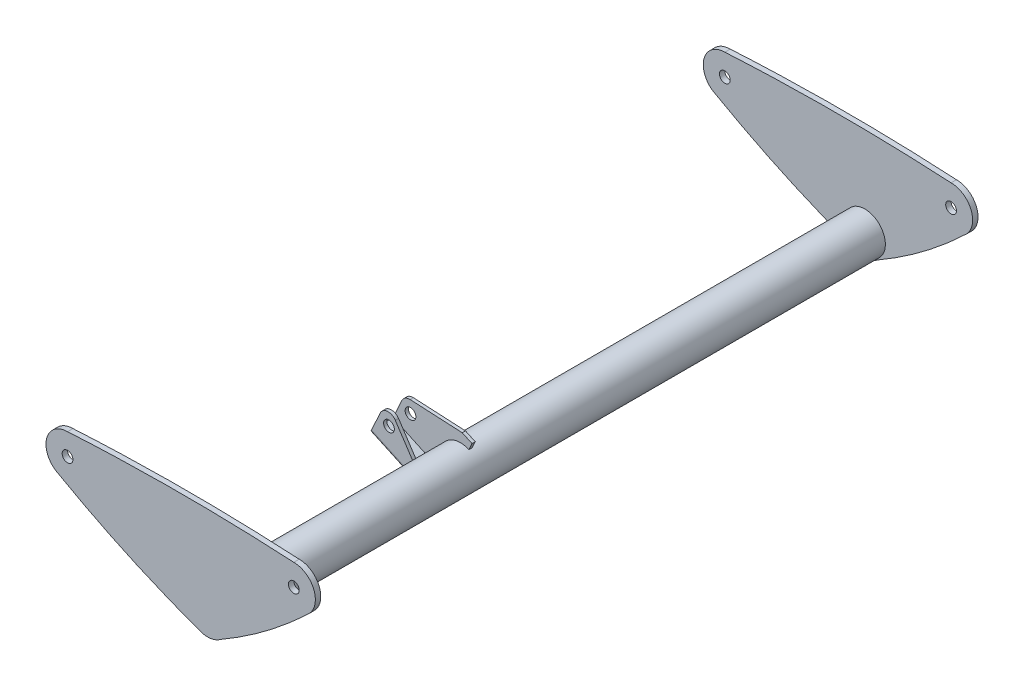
SolidWorks part; units mm, degrees
ref_plane "Plan de face" through (0, 0, 0) normal (0, 0, 1) x (1, 0, 0)
ref_plane "Plan de dessus" through (0, 0, 0) normal (0, 1, 0) x (1, 0, 0)
ref_plane "Plan de droite" through (0, 0, 0) normal (1, 0, 0) x (0, 0, -1)
sketch "Esquisse1" plane through (0, 0, 0) normal (0, 0, 1) x (1, 0, 0)
  line L0 (0, 20) -> (210, 20) construction
  line L1 (-8.3812, -18.1592) -> (121.6188, -78.1592) construction
  line L2 (142, -76) -> (222, -16) construction
  line L3 (105, 20) -> (105, 49.6761) construction
  line L4 (56.6188, -48.1592) -> (44.2232, -75.0164) construction
  line L5 (182, -46) -> (196.0565, -64.7421) construction
  circle A0 centre (0, 0) radius 5
  circle A1 centre (130, -60) radius 6.8924 construction
  circle A2 centre (210, 0) radius 5
  arc A3 (121.6188, -78.1592) -> (142, -76) centre (130, -60) ccw
  arc A4 (0, 20) -> (-8.3812, -18.1592) centre (0, 0) ccw
  arc A5 (222, -16) -> (210, 20) centre (210, 0) ccw
  spline S0 degree 2 poles (0, 20) (105, 26) (210, 20) knots 0 0 0 1 1 1
  spline S1 degree 2 poles (-8.3812, -18.1592) (54.1045, -53.6069) (121.6188, -78.1592) knots 0 0 0 1 1 1
  spline S2 degree 2 poles (142, -76) (185.6, -50.8) (222, -16) knots 0 0 0 1 1 1
  dimension "D1" = 10
  dimension "D3" = 40
  dimension "D4" = 130
  dimension "D5" = 60
  dimension "D2" = 210
  dimension "D6" = 3
  dimension "D7" = 3
  dimension "D8" = 3
extrude "Boss.-Extru.1" add sketch "Esquisse1" along normal blind 5
sketch "Esquisse2" plane through (0, 0, 0) normal (0, 0, -1) x (-1, 0, 0)
  circle A0 centre (-130, -60) radius 19
  dimension "D1" = 38
extrude "Extru.-Mince1" add sketch "Esquisse2" along normal blind 605 thin
ref_plane "Plan médian" through (0, 0, -302.5) normal (0, 0, -1) x (-1, 0, 0)
mirror "Symétrie1" about plane through (0, 0, -302.5) normal (0, 0, -1) of "Boss.-Extru.1"
ref_plane "Plan3" through (0, 0, -221) normal (0, 0, -1) x (-1, 0, 0)
ref_plane "Plan4" through (0, 0, -229.5) normal (0, 0, -1) x (-1, 0, 0)
sketch "Esquisse3" plane through (0, 0, -229.5) normal (0, 0, -1) x (-1, 0, 0)
  line L0 (-122.0379, -77.2512) -> (-67.5603, -52.1077)
  line L1 (-67.5603, -52.1077) -> (-75.7671, -34.3265)
  line L2 (-83.4458, -29.6897) -> (-131.8159, -32.2025)
  line L3 (-150.2605, -91.3784) -> (40.8812, -3.1592) construction
  line L4 (-140.8955, -36.3931) -> (-131.8159, -32.2025)
  line L5 (-130, -60) -> (-151.791, -12.7861) construction
  line L6 (-140.8955, -36.3931) -> (-137.9621, -42.7488)
  circle A0 centre (-130, -60) radius 19 construction
  arc A1 (-122.0379, -77.2512) -> (-137.9621, -42.7488) centre (-130, -60) ccw
  arc A2 (8.3812, -18.1592) -> (0, 20) centre (0, 0) ccw construction
  arc A3 (-142, -76) -> (-121.6188, -78.1592) centre (-130, -60) ccw construction
  arc A4 (-75.7671, -34.3265) -> (-83.4458, -29.6897) centre (-83.0307, -37.679) ccw
  point P19 (-78.0368, -29.4088)
  dimension "D5" = 8
  dimension "D1" = 60
  dimension "D2" = 25
  dimension "D3" = 45
  dimension "D4" = 10
extrude "Boss.-Extru.2" add sketch "Esquisse3" along normal blind 3
ref_plane "Plan5" through (0, 0, -212.5) normal (0, 0, -1) x (-1, 0, 0)
sketch "Esquisse4" plane through (0, 0, -212.5) normal (0, 0, -1) x (-1, 0, 0)
  line L0 (-67.5603, -52.1077) -> (-75.7671, -34.3265) construction
  line L4 (-67.5603, -52.1077) -> (-75.7671, -34.3265)
  line L5 (-89.7064, -33.2704) -> (-113.1256, -68.7324)
  line L10 (-122.0379, -77.2512) -> (-67.5603, -52.1077) construction
  line L11 (-122.0379, -77.2512) -> (-67.5603, -52.1077)
  arc A0 (-75.7671, -34.3265) -> (-83.4458, -29.6897) centre (-83.0307, -37.679) ccw construction
  arc A1 (-122.0379, -77.2512) -> (-137.9621, -42.7488) centre (-130, -60) ccw construction
  arc A2 (-75.7671, -34.3265) -> (-89.7064, -33.2704) centre (-83.0307, -37.679) ccw
  arc A3 (-122.0379, -77.2512) -> (-113.1256, -68.7324) centre (-130, -60) ccw
  dimension "D1" = 4
extrude "Boss.-Extru.3" add sketch "Esquisse4" against normal blind 3
sketch "Esquisse5" plane through (75.5224, -34.8565, 0) normal (-0.908, 0.4191, 0) x (0, 0, 1)
  line L0 (-212.5, -22) -> (-229.5, -22)
  line L1 (-209.5, -19) -> (-209.5, 0.5837) construction
  line L3 (-232.5, -19) -> (-232.5, 0.5837) construction
  line L5 (-200.8047, -19) -> (-232.5, -19) construction
  line L6 (-209.5, -19) -> (-212.5, -19) construction
  arc A0 (-212.5, -22) -> (-209.5, -19) centre (-212.5, -19) ccw
  arc A1 (-232.5, -19) -> (-229.5, -22) centre (-229.5, -19) ccw
  dimension "D1" = 3
extrude "Extru.-Mince4" add sketch "Esquisse5" against normal blind 59 thin
sketch "Esquisse6" plane through (0, 0, -232.5) normal (0, 0, -1) x (-1, 0, 0)
  line L0 (-119.8728, -79.556) -> (-66.3032, -54.8316) construction
  circle A0 centre (-83.8002, -40.8798) radius 5
  dimension "D1" = 10
  dimension "D2" = 20
  dimension "D3" = 50
extrude "Enlèv. mat.-Extru.1" cut sketch "Esquisse6" against normal up to surface (23 mm away)
